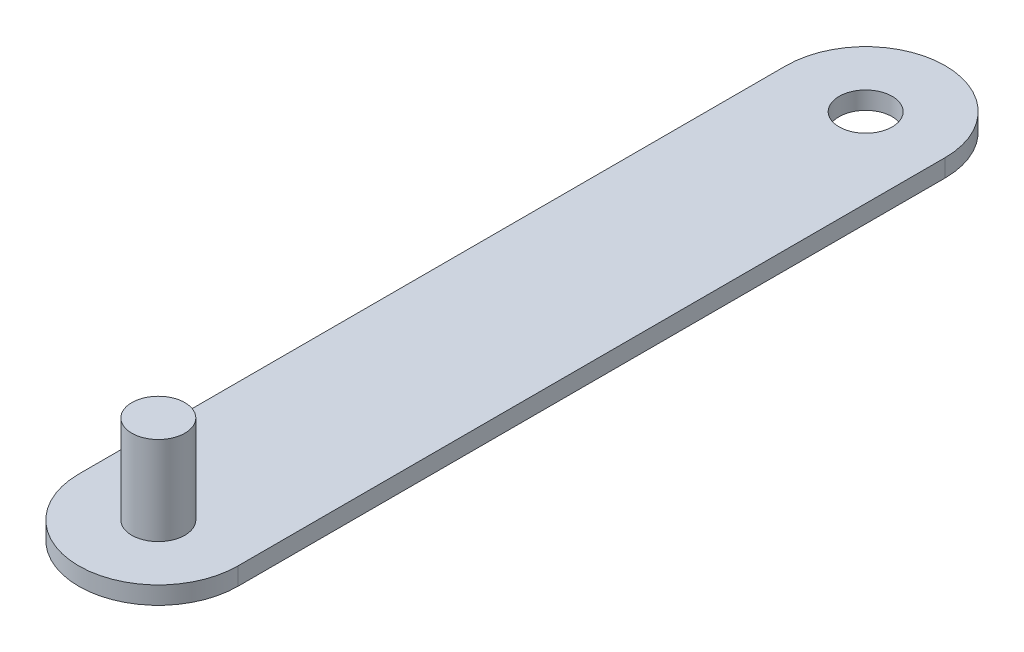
SolidWorks part; units mm, degrees
ref_plane "Front Plane" through (0, 0, 0) normal (0, 0, 1) x (1, 0, 0)
ref_plane "Top Plane" through (0, 0, 0) normal (0, 1, 0) x (1, 0, 0)
ref_plane "Right Plane" through (0, 0, 0) normal (1, 0, 0) x (0, 0, -1)
sketch "Sketch1" plane through (0, 0, 0) normal (0, 1, 0) x (1, 0, 0)
  line L1 (-225, -1000) -> (225, -1000)
  line L2 (-225, -1000) -> (-225, 1000)
  line L3 (-225, 1000) -> (225, 1000)
  line L4 (225, -1000) -> (225, 1000)
  line L5 (-225, -1000) -> (225, 1000) construction
  line L6 (-225, 1000) -> (225, -1000) construction
  arc A0 (225, -1000) -> (-225, -1000) centre (0, -1000) cw
  arc A1 (225, 1000) -> (-225, 1000) centre (0, 1000) ccw
  point P0 (0, 0)
  dimension "D1" = 2000
  dimension "D2" = 450
extrude "Boss-Extrude1" add sketch "Sketch1" along normal blind 50 contours L1 L4 L3 L2 | L3 A1 | A0 L1
sketch "Sketch2" plane through (0, 50, 0) normal (0, 1, 0) x (1, 0, 0)
  line L0 (-225, -1000) -> (225, -1000)
  line L1 (-225, -1000) -> (-225, 1000) construction
  circle A0 centre (0, -1000) radius 75
extrude "Boss-Extrude2" add sketch "Sketch2" along normal blind 250 contours L0 A0 | L0 A0
sketch "Sketch3" plane through (0, 50, 0) normal (0, 1, 0) x (1, 0, 0)
  line L0 (-225, 1000) -> (225, 1000)
  circle A0 centre (0, 1000) radius 75
extrude "Cut-Extrude2" cut sketch "Sketch3" against normal blind 250 contours L0 A0 | L0 A0
